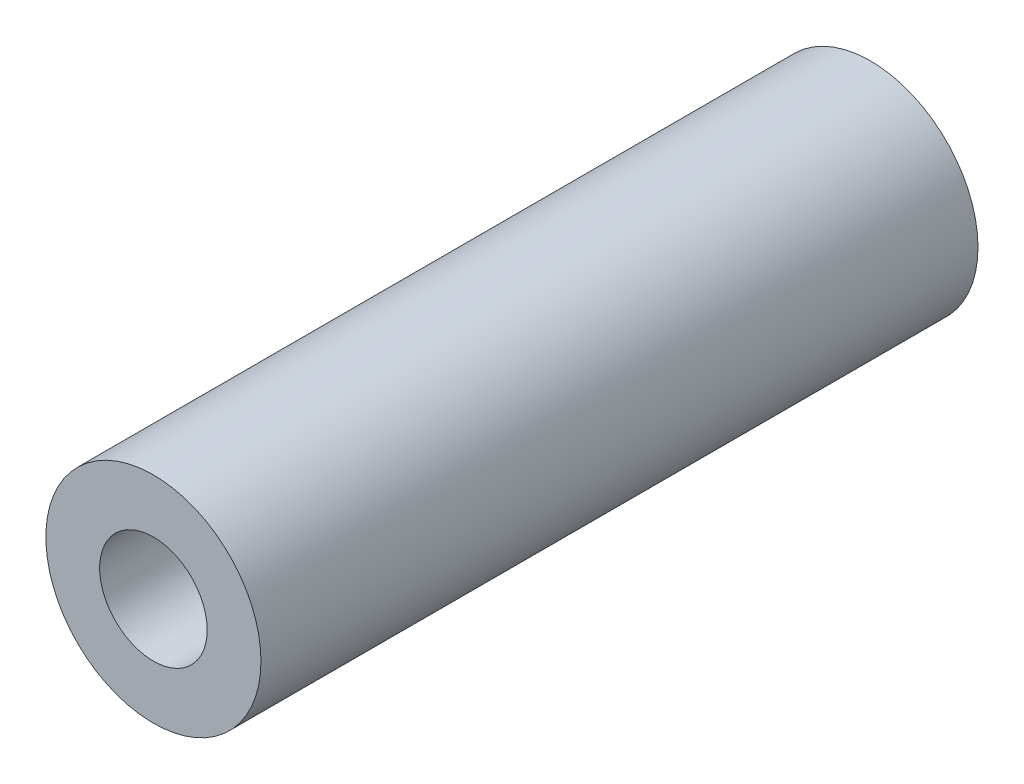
SolidWorks part; units mm, degrees
ref_plane "Face" through (0, 0, 0) normal (0, 0, 1) x (1, 0, 0)
ref_plane "Dessus" through (0, 0, 0) normal (0, 1, 0) x (1, 0, 0)
ref_plane "Droite" through (0, 0, 0) normal (1, 0, 0) x (0, 0, -1)
sketch "Esquisse1" plane through (0, 0, 0) normal (0, 0, 1) x (1, 0, 0)
  circle A0 centre (0, 0) radius 1.5
  circle A1 centre (0, 0) radius 3
  dimension "D1" = 3
  dimension "D2" = 6
extrude "Extrusion1" add sketch "Esquisse1" along normal blind 20
